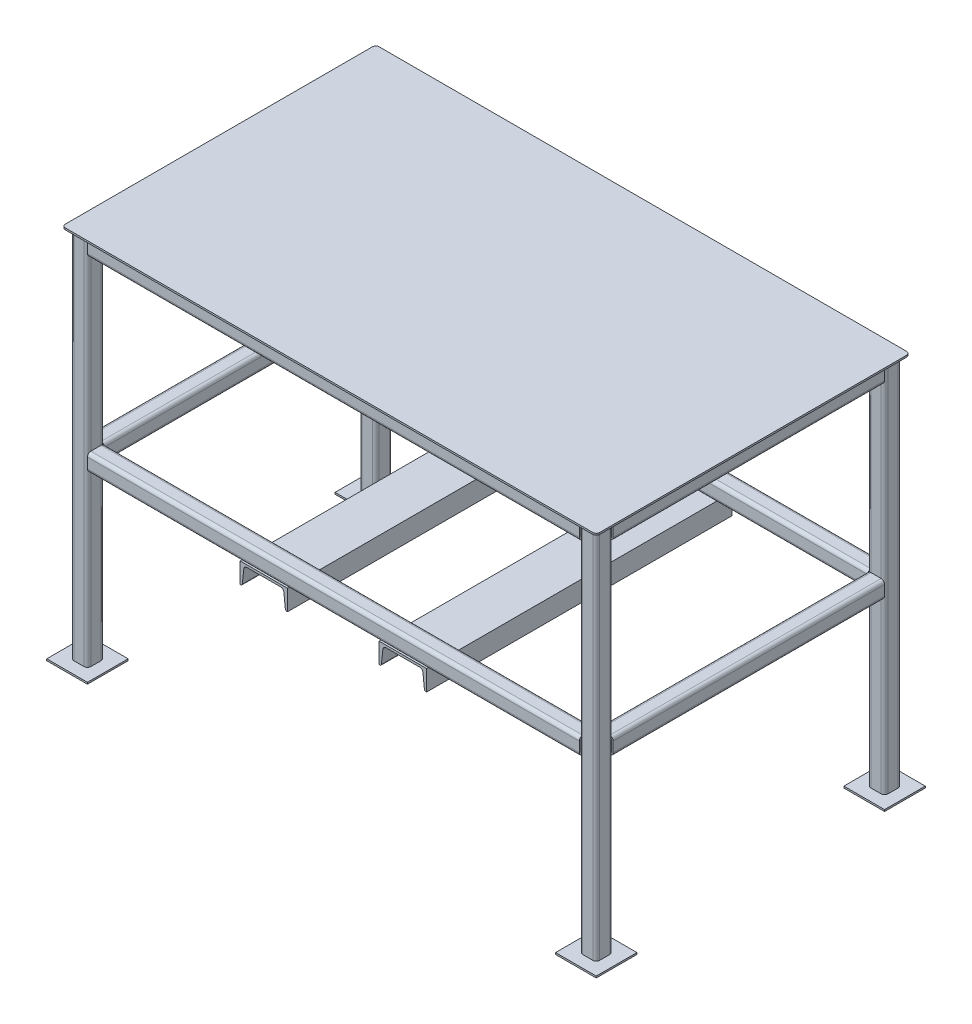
SolidWorks part; units mm, degrees
ref_plane "Default Plane" through (787.5, 1105, 452.5) normal (0, -1, 0) x (-1, 0, 0)
sketch3d "Bounding-Box_Cut-List-Item4"
  line L0 (0, 915, 0) -> (1575, 915, 0) construction
  line L1 (1575, 915, 0) -> (1575, -10, 0) construction
  line L2 (1575, -10, 0) -> (0, -10, 0) construction
  line L3 (0, -10, 0) -> (0, 915, 0) construction
  line L4 (0, 915, 5) -> (1575, 915, 5) construction
  line L5 (1575, 915, 5) -> (1575, -10, 5) construction
  line L6 (1575, -10, 5) -> (0, -10, 5) construction
  line L7 (0, -10, 5) -> (0, 915, 5) construction
  line L8 (0, 915, 0) -> (0, 915, 5) construction
  line L9 (1575, 915, 0) -> (1575, 915, 5) construction
  line L10 (1575, -10, 0) -> (1575, -10, 5) construction
  line L11 (0, -10, 0) -> (0, -10, 5) construction
ref_plane "Default Plane" through (810, 0, -365) normal (0, -1, 0) x (-1, 0, 0)
sketch3d "Bounding-Box_Cut-List-Item5"
  line L0 (120, 0, 0) -> (120, 120, 0) construction
  line L1 (120, 120, 0) -> (0, 120, 0) construction
  line L2 (0, 120, 0) -> (0, 0, 0) construction
  line L3 (0, 0, 0) -> (120, 0, 0) construction
  line L4 (120, 0, 5) -> (120, 120, 5) construction
  line L5 (120, 120, 5) -> (0, 120, 5) construction
  line L6 (0, 120, 5) -> (0, 0, 5) construction
  line L7 (0, 0, 5) -> (120, 0, 5) construction
  line L8 (120, 0, 0) -> (120, 0, 5) construction
  line L9 (120, 120, 0) -> (120, 120, 5) construction
  line L10 (0, 120, 0) -> (0, 120, 5) construction
  line L11 (0, 0, 0) -> (0, 0, 5) construction
ref_plane "Front Plane" through (0, 0, 0) normal (0, 0, 1) x (1, 0, 0)
ref_plane "Top Plane" through (0, 0, 0) normal (0, 1, 0) x (1, 0, 0)
ref_plane "Right Plane" through (0, 0, 0) normal (1, 0, 0) x (0, 0, -1)
sketch3d "Frame Layout"
  line L0 (-750, 0, 425) -> (-750, 1100, 425)
  line L1 (-750, 0, 425) -> (-750, 0, -425) construction
  line L2 (-750, 0, 425) -> (750, 0, 425) construction
  line L3 (750, 0, 425) -> (750, 0, -425) construction
  line L4 (-750, 0, -425) -> (750, 0, -425) construction
  line L5 (-750, 0, 425) -> (750, 0, -425) construction
  line L6 (750, 0, 425) -> (-750, 0, -425) construction
  line L7 (-750, 0, -425) -> (-750, 1100, -425)
  line L8 (750, 0, 425) -> (750, 1100, 425)
  line L9 (750, 0, -425) -> (750, 1100, -425)
  line L10 (0, 1100, -425) -> (0, 1100, 425)
  line L11 (-750, 1100, 425) -> (-750, 1100, -425)
  line L12 (-750, 1100, 425) -> (750, 1100, 425)
  line L13 (750, 1100, 425) -> (750, 1100, -425)
  line L14 (-750, 1100, -425) -> (750, 1100, -425)
  line L15 (-750, 550, 425) -> (-750, 550, -425)
  line L16 (-750, 550, -425) -> (750, 550, -425)
  line L17 (750, 550, -425) -> (750, 550, 425)
  line L18 (750, 550, 425) -> (-750, 550, 425)
  point P0 (0, 0, 0)
  dimension "D1" = 1500
  dimension "D2" = 850
  dimension "D3" = 1100
other "Tube (square) 50 X 50 X 5.0(2)"
ref_plane "Plane1" through (-750, 0, 425) normal (0, 1, 0) x (1, 0, 0)
sketch "Sketch1" plane through (-750, 0, 425) normal (0, 1, 0) x (1, 0, 0)
  line L0 (-15, -20) -> (15, -20)
  line L1 (-20, -15) -> (-20, 15)
  line L2 (15, 20) -> (-15, 20)
  line L3 (20, 15) -> (20, -15)
  line L4 (-15, -25) -> (15, -25)
  line L5 (-25, -15) -> (-25, 15)
  line L6 (15, 25) -> (-15, 25)
  line L7 (25, 15) -> (25, -15)
  line L8 (-25, 0) -> (-20, 0) construction
  line L9 (-20, 0) -> (20, 0) construction
  line L10 (20, 0) -> (25, 0) construction
  line L12 (0, 25) -> (0, 20) construction
  line L13 (0, 20) -> (0, -20) construction
  line L14 (0, -20) -> (0, -25) construction
  arc A0 (25, 15) -> (15, 25) centre (15, 15) ccw
  arc A1 (15, -25) -> (25, -15) centre (15, -15) ccw
  arc A2 (-25, -15) -> (-15, -25) centre (-15, -15) ccw
  arc A3 (-15, 25) -> (-25, 15) centre (-15, 15) ccw
  arc A4 (-15, 20) -> (-20, 15) centre (-15, 15) ccw
  arc A5 (20, 15) -> (15, 20) centre (15, 15) ccw
  arc A6 (15, -20) -> (20, -15) centre (15, -15) ccw
  arc A7 (-20, -15) -> (-15, -20) centre (-15, -15) ccw
  point P2 (-25, 25)
  point P33 (-25, -25)
  point P34 (25, -25)
  point P36 (25, 25)
  point P37 (0, 0)
  dimension "D1" = 10
  dimension "Thickness" = 5
  dimension "V_leg" = 50
  dimension "H_leg" = 50
sketch "Sketch2" plane through (0, 1100, 0) normal (0, 1, 0) x (1, 0, 0)
  line L1 (787.5, 462.5) -> (-787.5, 462.5)
  line L2 (787.5, 462.5) -> (787.5, -462.5)
  line L3 (787.5, -462.5) -> (-787.5, -462.5)
  line L4 (-787.5, 462.5) -> (-787.5, -462.5)
  line L5 (787.5, 462.5) -> (-787.5, -462.5) construction
  line L6 (787.5, -462.5) -> (-787.5, 462.5) construction
  point P0 (0, 0)
  dimension "D1" = 1575
  dimension "D2" = 925
extrude "Top Plate" add sketch "Sketch2" along normal blind 5 separate body
sketch "Sketch3" plane through (0, 0, 0) normal (0, -1, 0) x (1, 0, 0)
  line L0 (-765, 450) -> (-735, 450) construction
  line L1 (-810, 485) -> (-690, 485)
  line L2 (-810, 485) -> (-810, 365)
  line L3 (-810, 365) -> (-690, 365)
  line L4 (-690, 485) -> (-690, 365)
  line L5 (-750, 365) -> (-750, 485) construction
  line L6 (-810, 425) -> (-690, 425) construction
  line L7 (-725, 440) -> (-725, 410) construction
  point P0 (-750, 425)
  point P6 (-750, 450)
  point P9 (-725, 425)
  dimension "D1" = 120
extrude "Base Plate" add sketch "Sketch3" along normal blind 5 separate body
mirror "Mirror1" about plane through (0, 0, 0) normal (0, 0, 1)
mirror "Mirror2" about plane through (0, 0, 0) normal (1, 0, 0)
fillet "Fillet1" radius 10 4 edges at (-787.5, 1102.5, -462.5) (787.5, 1102.5, -462.5) (787.5, 1102.5, 462.5) (-787.5, 1102.5, 462.5)
sketch "Channel Layout" plane through (0, 500, 0) normal (0, -1, 0) x (1, 0, 0)
  line L0 (0, -450) -> (0, 450) construction
  line L1 (725, 450) -> (-725, 450) construction
  line L2 (-205, 450) -> (-205, -450)
  line L3 (725, -450) -> (-725, -450) construction
  line L4 (205, 450) -> (205, -450)
  point P4 (0, 0)
  dimension "D1" = 410
other "C channel CH 140 X 15(1)"
ref_plane "Plane2" through (-135, 500, 450) normal (0, 0, -1) x (0, -1, 0)
sketch "Sketch11" plane through (-135, 500, 450) normal (0, 0, -1) x (0, -1, 0)
  line L0 (60, 140) -> (0, 140)
  line L1 (60, 0) -> (0, 0)
  line L2 (0, 140) -> (0, 0)
  line L5 (0, 9) -> (30.8145, 9) construction
  line L6 (60, 140) -> (60, 137.8528)
  line L7 (60, 0) -> (60, 2.1472)
  line L12 (6.7, 120.0953) -> (6.7, 19.9047)
  line L17 (14.7592, 129.046) -> (55.9704, 133.3775)
  line L18 (14.7592, 10.954) -> (55.9704, 6.6225)
  arc A0 (55.9704, 133.3775) -> (60, 137.8528) centre (55.5, 137.8528) ccw
  arc A1 (55.9704, 6.6225) -> (60, 2.1472) centre (55.5, 2.1472) cw
  arc A9 (6.7, 19.9047) -> (14.7592, 10.954) centre (15.7, 19.9047) ccw
  arc A10 (6.7, 120.0953) -> (14.7592, 129.046) centre (15.7, 120.0953) cw
  point P10 (30, 140)
  point P11 (30, 0)
  point P12 (6.7, 70)
  point P13 (0, 70)
  point P14 (0, 0)
  dimension "RI" = 9
  dimension "D2" = 6
  dimension "RA" = 4.5
  dimension "D3" = 19.9047
  dimension "Depth" = 140
  dimension "BF" = 60
  dimension "TW" = 6.7
  dimension "TF" = 9
  dimension "d1" = 100.1907
